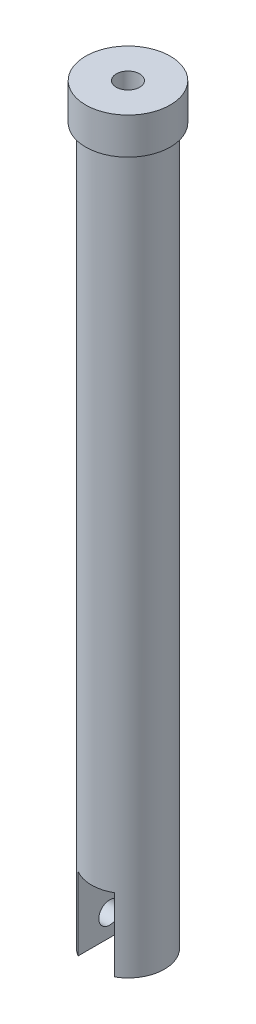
SolidWorks part; units mm, degrees
ref_plane "Plan de face" through (0, 0, 0) normal (0, 0, 1) x (1, 0, 0)
ref_plane "Plan de dessus" through (0, 0, 0) normal (0, 1, 0) x (1, 0, 0)
ref_plane "Plan de droite" through (0, 0, 0) normal (1, 0, 0) x (0, 0, -1)
sketch "Esquisse2" plane through (0, 0, 0) normal (0, 1, 0) x (1, 0, 0)
  circle A0 centre (0, 0) radius 50
  circle A1 centre (0, 0) radius 42
  dimension "D1" = 100
  dimension "D2" = 8
extrude "Boss.-Extru.1" add sketch "Esquisse2" along normal blind 875
sketch "Esquisse3" plane through (0, 0, 0) normal (0, -1, 0) x (1, 0, 0)
  circle A2 centre (0, 0) radius 50 construction
  circle A3 centre (0, 0) radius 50
extrude "Boss.-Extru.2" add sketch "Esquisse3" along normal blind 5
sketch "Esquisse4" plane through (0, -5, 0) normal (0, -1, 0) x (1, 0, 0)
  line L0 (0, 50.5861) -> (0, -50.5861) construction
  line L1 (-25, 43.3013) -> (-25, -43.3013)
  line L2 (25, 43.3013) -> (25, -43.3013)
  arc A0 (25, -43.3013) -> (25, 43.3013) centre (0, 0) ccw
  circle A1 centre (0, 0) radius 50
  arc A2 (-25, 43.3013) -> (-25, -43.3013) centre (0, 0) ccw
  dimension "D2" = 50
  dimension "D1" = 0
extrude "Boss.-Extru.3" add sketch "Esquisse4" along normal blind 100
sketch "Esquisse5" plane through (0, 0, 0) normal (1, 0, 0) x (0, 0, -1)
  line L0 (0, 0) -> (0, -179.8048) construction
  line L1 (-43.3013, -105) -> (43.3013, -105) construction
  circle A0 centre (0, -75) radius 15
  dimension "D1" = 30
  dimension "D2" = 30
extrude "Enlèv. mat.-Extru.1" cut sketch "Esquisse5" against normal blind 80 and the other way blind 45
sketch "Esquisse6" plane through (0, 875, 0) normal (0, 1, 0) x (1, 0, 0)
  circle A0 centre (0, 0) radius 58
  circle A1 centre (0, 0) radius 50 construction
  circle A2 centre (0, 0) radius 16
  dimension "D1" = 8
  dimension "D2" = 32
extrude "Boss.-Extru.4" add sketch "Esquisse6" along normal blind 50
sketch "Esquisse7" plane through (0, 0, 0) normal (1, 0, 0) x (0, 0, -1)
  circle A0 centre (0, -75) radius 15 construction
  point P0 (0, -75)
